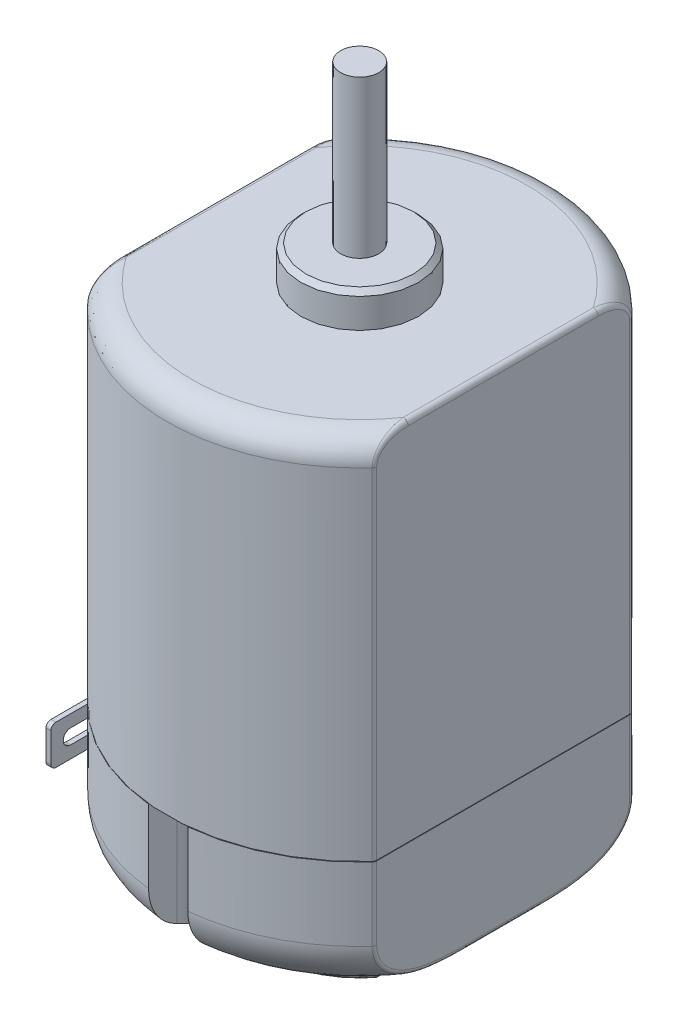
SolidWorks part; units mm, degrees
ref_plane "Front Plane" through (0, 0, 0) normal (0, 0, 1) x (1, 0, 0)
ref_plane "Top Plane" through (0, 0, 0) normal (0, 1, 0) x (1, 0, 0)
ref_plane "Right Plane" through (0, 0, 0) normal (1, 0, 0) x (0, 0, -1)
sketch "Sketch1" plane through (0, 0, 0) normal (0, 1, 0) x (1, 0, 0)
  line L2 (-7.4295, -6.6478) -> (-7.4295, 6.6478)
  line L4 (7.4295, -6.6478) -> (7.4295, 6.6478)
  arc A0 (-7.4295, -6.6478) -> (7.4295, -6.6478) centre (0, 0) ccw
  arc A1 (7.4295, 6.6478) -> (-7.4295, 6.6478) centre (0, 0) ccw
  point P0 (0, 0)
extrude "Extrude1" add sketch "Sketch1" along normal blind 25.273
fillet "Fillet1" radius 1.27 2 edges at (0, 25.273, 9.9695) (0, 25.273, -9.9695)
fillet "Fillet2" radius 0.254 10 edges at (-7.4295, 12.0015, -6.6478) (-7.4295, 24.8911, -6.0912) (-7.4295, 12.0015, 6.6478) (-7.4295, 24.597, 6.4246) (7.4295, 12.0015, 6.6478) (7.4295, 24.8911, 6.0912) (7.4295, 12.0015, -6.6478) (7.4295, 24.597, -6.4246) (-7.4295, 25.273, 0) (7.4295, 25.273, 0)
fillet "Fillet3" radius 2.54 2 edges at (0, 0, 9.9695) (0, 0, -9.9695)
fillet "Fillet4" radius 0.254 4 edges at (-7.4295, 0.8281, -5.6038) (7.4295, 0.5801, -5.1593) (-7.4295, 0.5801, 5.1593) (7.4295, 0.8281, 5.6038)
sketch "Sketch2" plane through (0, 0, 0) normal (0, -1, 0) x (1, 0, 0)
  line L1 (3.937, -3.0054) -> (3.937, 3.0054)
  arc A0 (3.937, 3.0054) -> (3.937, -3.0054) centre (0, 0) ccw
  dimension "D1" = 9.906
extrude "Extrude2" add sketch "Sketch2" along normal blind 2.54
fillet "Fillet5" radius 0.254 4 edges at (-4.953, -2.54, 0) (3.937, -2.54, 0) (3.937, 0, 0) (-4.953, 0, 0)
sketch "Sketch3" plane through (0, 25.273, 0) normal (0, 1, 0) x (1, 0, 0)
  circle A0 centre (0, 0) radius 3.048
  dimension "D1" = 6.096
extrude "Extrude3" add sketch "Sketch3" along normal blind 1.778
chamfer "Chamfer1" distance 0.254 angle 45 1 edges at (0, 27.051, 3.048)
sketch "Sketch4" plane through (0, 27.051, 0) normal (0, 1, 0) x (1, 0, 0)
  circle A0 centre (0, 0) radius 0.9906
  dimension "D1" = 1.9812
extrude "Extrude4" add sketch "Sketch4" along normal blind 8.128
sketch "Sketch5" plane through (-7.4295, 0, 0) normal (-1, 0, 0) x (0, 0, 1)
  line L1 (-3.81, 5.334) -> (3.81, 5.334)
  line L2 (0, 0.254) -> (0, 5.334) construction
  line L3 (3.81, 0.3621) -> (3.81, 5.334)
  line L5 (-3.81, 0.3621) -> (-3.81, 5.334)
  line L6 (-1.9261, 0.254) -> (1.9261, 0.254) construction
  line L7 (-1.9261, 0.254) -> (1.9261, 0.254)
  line L8 (3.81, 0) -> (3.81, 5.334) construction
  line L9 (0, 0) -> (0, 5.334) construction
  spline S4 degree 3 poles (213.3436, -2991.6934) (-52.5614, 83.5081) (-20.4804, -1.885) (3.5779, 0.328) (3.812, 0.3582) (4.2778, 0.4446) (4.5112, 0.5013) (4.9625, 0.6491) (5.1811, 0.74) (5.5982, 0.9696) (5.7957, 1.1086) (6.1385, 1.4378) (6.2865, 1.6317) (6.4411, 1.9552) (6.4819, 2.0697) (9.9619, 16.9594) (-197.98, 71.4995) (-2932.7876, 601.3765) knots -12.425387 -12.425387 -12.425387 -12.425387 0.25 0.25 0.375 0.375 0.5 0.5 0.625 0.625 0.75 0.75 0.875 0.875 0.9375 0.9375 8.918408 8.918408 8.918408 8.918408 only from (1.9261, 0.254) to (6.55, 2.54) construction
  spline S5 degree 3 poles (1370.1493, -2660.928) (81.0711, 58.0051) (-8.8167, 12.0278) (-6.4817, 2.0691) (-6.4421, 1.9578) (-6.3394, 1.742) (-6.2767, 1.6392) (-6.1355, 1.4484) (-6.0565, 1.3594) (-5.7973, 1.1096) (-5.6039, 0.9734) (-5.1883, 0.7434) (-4.9667, 0.6508) (-4.5162, 0.5026) (-4.2843, 0.446) (-3.8164, 0.3588) (-3.5814, 0.3284) (20.4661, -1.8909) (51.0563, 83.6067) (-162.9072, -2994.8417) knots -5.281316 -5.281316 -5.281316 -5.281316 0.0625 0.0625 0.125 0.125 0.1875 0.1875 0.25 0.25 0.375 0.375 0.5 0.5 0.625 0.625 0.75 0.75 13.382312 13.382312 13.382312 13.382312 only from (-6.55, 2.54) to (-1.9261, 0.254) construction
  spline S6 degree 3 poles (1.9261, 0.254) (2.4, 0.254) (2.8731, 0.2631) (3.499, 0.3207) (3.6548, 0.3389) (3.81, 0.3621) knots 0 0 0 0 0.25 0.25 0.333042 0.333042 0.333042 0.333042
  spline S7 degree 3 poles (-3.81, 0.3621) (-3.6556, 0.339) (-3.5009, 0.3209) (-2.8746, 0.2631) (-2.4007, 0.254) (-1.9261, 0.254) knots 0.667745 0.667745 0.667745 0.667745 0.75 0.75 1 1 1 1
  dimension "D2" = 3.81
extrude "Extrude5" add sketch "Sketch5" along normal blind 1.1938
fillet "Fillet6" radius 1.27 3 edges
sketch "Sketch6" plane through (0, -2.54, 0) normal (0, -1, 0) x (1, 0, 0)
  circle A0 centre (0, 0) radius 0.9906
  dimension "D1" = 1.9812
extrude "Extrude6" add sketch "Sketch6" along normal blind 0.762
chamfer "Chamfer2" distance 0.254 angle 45 1 edges at (0, -3.302, -0.9906)
sketch "Sketch7" plane through (-8.6233, 0, 0) normal (-1, 0, 0) x (0, 0, 1)
  line L0 (3.81, 5.0509) -> (7.366, 5.0509)
  line L1 (3.81, 1.6472) -> (3.81, 5.334) construction
  line L2 (7.62, 4.7969) -> (7.62, 3.2729)
  line L3 (7.366, 3.0189) -> (3.81, 3.0189)
  line L4 (3.81, 0.3623) -> (3.81, 5.334) construction
  line L5 (3.81, 3.0189) -> (3.81, 5.0509)
  line L6 (6.604, 4.0349) -> (5.0175, 4.0349) construction
  line L7 (6.604, 3.6539) -> (5.0175, 3.6539)
  line L8 (6.604, 4.4159) -> (5.0175, 4.4159)
  line L10 (0, 1.5217) -> (0, 5.334) construction
  line L11 (-1.9261, 1.5217) -> (1.9261, 1.5217) construction
  line L12 (3.81, 5.334) -> (-3.81, 5.334) construction
  line L13 (-6.604, 4.0349) -> (-5.0175, 4.0349) construction
  line L14 (-6.604, 3.6539) -> (-5.0175, 3.6539)
  line L15 (-6.604, 4.4159) -> (-5.0175, 4.4159)
  line L16 (-3.81, 3.0189) -> (-3.81, 5.0509)
  line L17 (-7.366, 3.0189) -> (-3.81, 3.0189)
  line L18 (-7.62, 4.7969) -> (-7.62, 3.2729)
  line L19 (-3.81, 5.0509) -> (-7.366, 5.0509)
  arc A0 (7.366, 5.0509) -> (7.62, 4.7969) centre (7.366, 4.7969) cw
  arc A1 (7.62, 3.2729) -> (7.366, 3.0189) centre (7.366, 3.2729) cw
  arc A2 (6.604, 3.6539) -> (6.604, 4.4159) centre (6.604, 4.0349) ccw
  arc A3 (5.0175, 4.4159) -> (5.0175, 3.6539) centre (5.0175, 4.0349) ccw
  arc A4 (-6.604, 3.6539) -> (-6.604, 4.4159) centre (-6.604, 4.0349) cw
  arc A5 (-5.0175, 4.4159) -> (-5.0175, 3.6539) centre (-5.0175, 4.0349) cw
  arc A6 (-7.62, 3.2729) -> (-7.366, 3.0189) centre (-7.366, 3.2729) ccw
  arc A7 (-7.366, 5.0509) -> (-7.62, 4.7969) centre (-7.366, 4.7969) ccw
  point P10 (7.62, 5.0509)
  point P13 (7.62, 3.0189)
  point P16 (5.8108, 4.0349)
  point P29 (-5.8108, 4.0349)
  point P42 (-7.62, 3.0189)
  point P43 (-7.62, 5.0509)
  dimension "D3" = 0.254
  dimension "D4" = 1.016
  dimension "D1" = 2.032
  dimension "D2" = 3.81
  dimension "D5" = 1.016
extrude "Extrude7" add sketch "Sketch7" against normal blind 0.254
sketch "Sketch8" plane through (-8.6233, 0, 0) normal (-1, 0, 0) x (0, 0, 1)
  line L0 (3.81, 3.0189) -> (3.81, 5.0509)
  line L1 (-3.81, 3.0189) -> (-3.81, 5.0509)
  line L12 (-1.9261, 1.5217) -> (1.9261, 1.5217)
  line L13 (3.81, 1.6472) -> (3.81, 3.0189)
  line L14 (3.81, 3.0189) -> (7.366, 3.0189)
  line L15 (7.62, 3.2729) -> (7.62, 4.7969)
  line L16 (7.366, 5.0509) -> (3.81, 5.0509)
  line L17 (3.81, 5.0509) -> (3.81, 5.334)
  line L18 (3.81, 5.334) -> (-3.81, 5.334)
  line L19 (-3.81, 5.334) -> (-3.81, 5.0509)
  line L20 (-3.81, 5.0509) -> (-7.366, 5.0509)
  line L21 (-7.62, 4.7969) -> (-7.62, 3.2729)
  line L22 (-7.366, 3.0189) -> (-3.81, 3.0189)
  line L23 (-3.81, 3.0189) -> (-3.81, 1.6472)
  line L24 (-1.9261, 1.5217) -> (1.9261, 1.5217)
  line L25 (3.81, 1.6472) -> (3.81, 3.0189)
  line L29 (3.81, 5.0509) -> (3.81, 5.334)
  line L30 (3.81, 5.334) -> (-3.81, 5.334)
  line L31 (-3.81, 5.334) -> (-3.81, 5.0509)
  line L35 (-3.81, 3.0189) -> (-3.81, 1.6472)
  arc A4 (7.366, 3.0189) -> (7.62, 3.2729) centre (7.366, 3.2729) ccw
  arc A5 (7.62, 4.7969) -> (7.366, 5.0509) centre (7.366, 4.7969) ccw
  arc A6 (-7.366, 5.0509) -> (-7.62, 4.7969) centre (-7.366, 4.7969) ccw
  arc A7 (-7.62, 3.2729) -> (-7.366, 3.0189) centre (-7.366, 3.2729) ccw
  spline S2 degree 2 poles (-2976.8877, 356.8099) (-47.7235, -1.2264) (2.8714, 1.543) (84.7805, 6.0263) (-2786.306, 1103.2241) knots -64.697814 -64.697814 -64.697814 0.5 0.5 77.557543 77.557543 77.557543 only from (1.9261, 1.5217) to (3.81, 1.6472)
  spline S3 degree 2 poles (2790.5769, 1092.4582) (-84.5991, 6.0259) (-2.8714, 1.543) (47.3378, -1.2111) (2977.3648, 352.9758) knots -76.319145 -76.319145 -76.319145 0.5 0.5 65.356331 65.356331 65.356331 only from (-3.81, 1.6472) to (-1.9261, 1.5217)
  spline S4 degree 2 poles (1.9261, 1.5217) (2.4834, 1.5217) (2.8714, 1.543) (3.4028, 1.5721) (3.81, 1.6472) knots 0 0 0 0.5 0.5 1 1 1
  spline S5 degree 2 poles (-3.81, 1.6472) (-3.4033, 1.5721) (-2.8714, 1.543) (-2.4843, 1.5217) (-1.9261, 1.5217) knots 0 0 0 0.5 0.5 1 1 1
  dimension "D1" = 0
extrude "Extrude8" add sketch "Sketch8" along normal blind 0.0254
ref_plane "Plane1" through (0, 6.35, 0) normal (0, 1, 0) x (-1, 0, 0)
sketch "Sketch10" plane through (0, 6.35, 0) normal (0, 1, 0) x (-1, 0, 0)
  line L0 (6.4135, 6.2476) -> (6.4135, -6.2476)
  line L1 (7.4295, 6.6478) -> (7.4295, -6.6478)
  line L2 (-6.4135, -6.2476) -> (-6.4135, 6.2476)
  line L3 (-7.4295, -6.6478) -> (-7.4295, 6.6478)
  arc A0 (-7.4295, -6.6478) -> (7.4295, -6.6478) centre (0, 0) ccw
  arc A1 (7.4295, 6.6478) -> (-7.4295, 6.6478) centre (0, 0) ccw
  arc A2 (-6.4135, -6.2476) -> (6.4135, -6.2476) centre (0, 0) ccw
  arc A3 (6.4135, 6.2476) -> (-6.4135, 6.2476) centre (0, 0) ccw
  dimension "D1" = 1.016
extrude "Extrude11" cut sketch "Sketch10" against normal blind 0.0254
sketch "Sketch11" plane through (0, 0, 0) normal (0, 1, 0) x (1, 0, 0)
  line L0 (0, -7.4295) -> (0, -9.9695) construction
  line L1 (-1.016, -8.4455) -> (-1.016, -9.9176)
  line L2 (1.016, -8.4455) -> (1.016, -9.9176)
  line L3 (0, 0) -> (6.9747, 0) construction
  line L4 (0, 7.4295) -> (0, 9.9695) construction
  line L5 (1.016, 8.4455) -> (1.016, 9.9176)
  line L6 (-1.016, 8.4455) -> (-1.016, 9.9176)
  arc A0 (-7.1755, -1.9261) -> (7.1755, -1.9261) centre (0, 0) ccw construction
  arc A1 (-7.3631, -6.7213) -> (7.3631, -6.7213) centre (0, 0) ccw construction
  arc A2 (1.016, -8.4455) -> (-1.016, -8.4455) centre (0, -8.4455) ccw
  arc A3 (1.016, 8.4455) -> (-1.016, 8.4455) centre (0, 8.4455) cw
  arc A4 (1.016, 9.9176) -> (-1.016, 9.9176) centre (0, 0) ccw
  arc A5 (-1.016, -9.9176) -> (1.016, -9.9176) centre (0, 0) ccw
extrude "Extrude12" cut sketch "Sketch11" along normal blind 6.35
